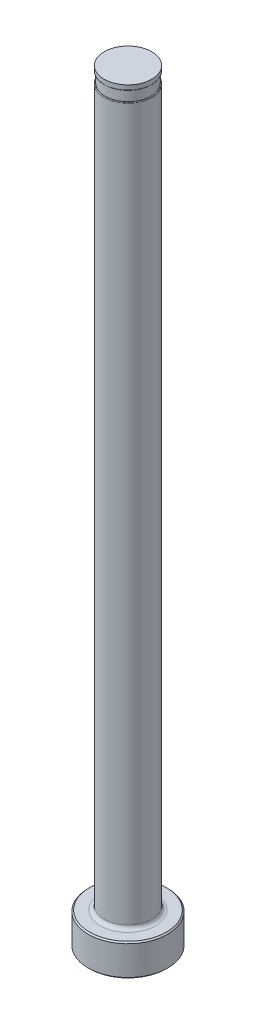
SolidWorks part; units mm, degrees
ref_plane "Front Plane" through (0, 0, 0) normal (0, 0, 1) x (1, 0, 0)
ref_plane "Top Plane" through (0, 0, 0) normal (0, 1, 0) x (1, 0, 0)
ref_plane "Right Plane" through (0, 0, 0) normal (1, 0, 0) x (0, 0, -1)
other "Configuration Table"
sketch "Sketch1" plane through (0, 0, 0) normal (0, 0, 1) x (1, 0, 0)
  line L0 (0, 259.9588) -> (0, -15.1925) construction
  line L1 (0, 0) -> (-7.9375, 0)
  line L2 (-7.9375, 0) -> (-7.9375, 6.35)
  line L3 (-7.9375, 6.35) -> (-4.7625, 6.35)
  line L4 (-4.7625, 6.35) -> (-4.7625, 152.4)
  line L5 (-4.7625, 152.4) -> (0, 152.4)
  line L6 (0, 152.4) -> (0, 0)
  dimension "L" = 152.4
  dimension "H" = 15.875
  dimension "T" = 6.35
  dimension "D" = 9.525
revolve "Revolve1" add sketch "Sketch1" angle 360 about L0
chamfer "Chamfer1" distance 0.254 angle 45 2 edges at (0, 6.35, 7.9375) (0, 0, 7.9375)
fillet "Fillet1" radius 0.762 1 edges at (0, 6.35, 4.7625)
sketch "Sketch2" plane through (0, 0, 0) normal (0, 0, 1) x (1, 0, 0)
  line L0 (-4.7625, 152.4) -> (-4.7625, 7.112) construction
  line L1 (-4.7625, 151.384) -> (-4.5593, 151.384)
  line L2 (-4.7625, 151.384) -> (-4.7625, 149.352)
  line L3 (-4.7625, 149.352) -> (-4.5593, 149.352)
  line L4 (-4.5593, 151.384) -> (-4.5593, 149.352)
  line L5 (4.7625, 152.4) -> (-4.7625, 152.4) construction
  line L6 (0, 153.4483) -> (0, 147.3282) construction
  dimension "D1" = 2.032
  dimension "N" = 1.016
  dimension "FD" = 0.2032
  dimension "D3" = 9.1186
revolve "Vent Relief" cut sketch "Sketch2" angle 360 about L6
sketch "Sketch3" plane through (0, 0, 0) normal (0, 0, 1) x (1, 0, 0)
  line L0 (-4.5593, 150.368) -> (-4.5593, 86.868)
  line L1 (-4.5593, 151.384) -> (-4.5593, 149.352) construction
  line L2 (-4.7625, 149.352) -> (-4.7625, 7.112) construction
  line L3 (-4.7625, 85.7504) -> (-4.7625, 150.368)
  line L4 (-4.7625, 150.368) -> (-4.5593, 150.368)
  arc A0 (-4.5593, 86.868) -> (-4.7625, 85.7504) centre (-7.7343, 86.868) cw
  dimension "D1" = 3.175
  dimension "D2" = 63.5
extrude "D-Slot" cut sketch "Sketch3" against normal through all both and the other way through all
sketch "Sketch5" plane through (0, 0, 0) normal (0, 0, 1) x (1, 0, 0)
  line L0 (-4.7625, 151.384) -> (4.7625, 151.384) construction
  line L1 (-4.7625, 152.4) -> (-4.7574, 152.4)
  line L2 (-4.7625, 152.4) -> (-4.7625, 151.384)
  line L3 (-4.7625, 151.384) -> (-4.7574, 151.384)
  line L4 (-4.7574, 152.4) -> (-4.7574, 151.384)
  line L5 (0, 152.6877) -> (0, 150.5771) construction
  dimension "VP" = 0.0051
revolve "Vent Diameter" cut sketch "Sketch5" angle 360 about L5
fillet "Fillet2" radius 0.127 2 edges at (4.7625, 149.352, 0) (0, 151.384, 4.7574)
sketch "Pocket Sketch" plane through (0, 0, 0) normal (0, 0, 1) x (1, 0, 0)
  line L0 (-8.3344, 0) -> (-8.3344, 6.3754)
  line L1 (-8.3344, 6.3754) -> (-5.7229, 6.3754)
  line L2 (-4.9609, 7.1374) -> (-4.9609, 22.225)
  line L3 (-4.9609, 22.225) -> (0, 22.225)
  line L4 (0, 22.225) -> (0, 0)
  line L5 (0, 0) -> (-8.3344, 0)
  line L6 (0, 12.6104) -> (0, -2.4989) construction
  line L7 (-7.9375, 6.096) -> (-7.9375, 0.254) construction
  line L8 (7.6835, 6.35) -> (-7.6835, 6.35) construction
  line L9 (-4.7625, 85.7504) -> (-4.7625, 7.112) construction
  line L10 (-5.7229, 6.3754) -> (-4.9609, 7.1374)
  point P3 (-4.9609, 6.3754)
  dimension "D1" = 16.6687
  dimension "D2" = 0.3969
  dimension "D3" = 0.0254
  dimension "D4" = 0.1984
  dimension "D5" = 9.9219
  dimension "D6" = 22.225
